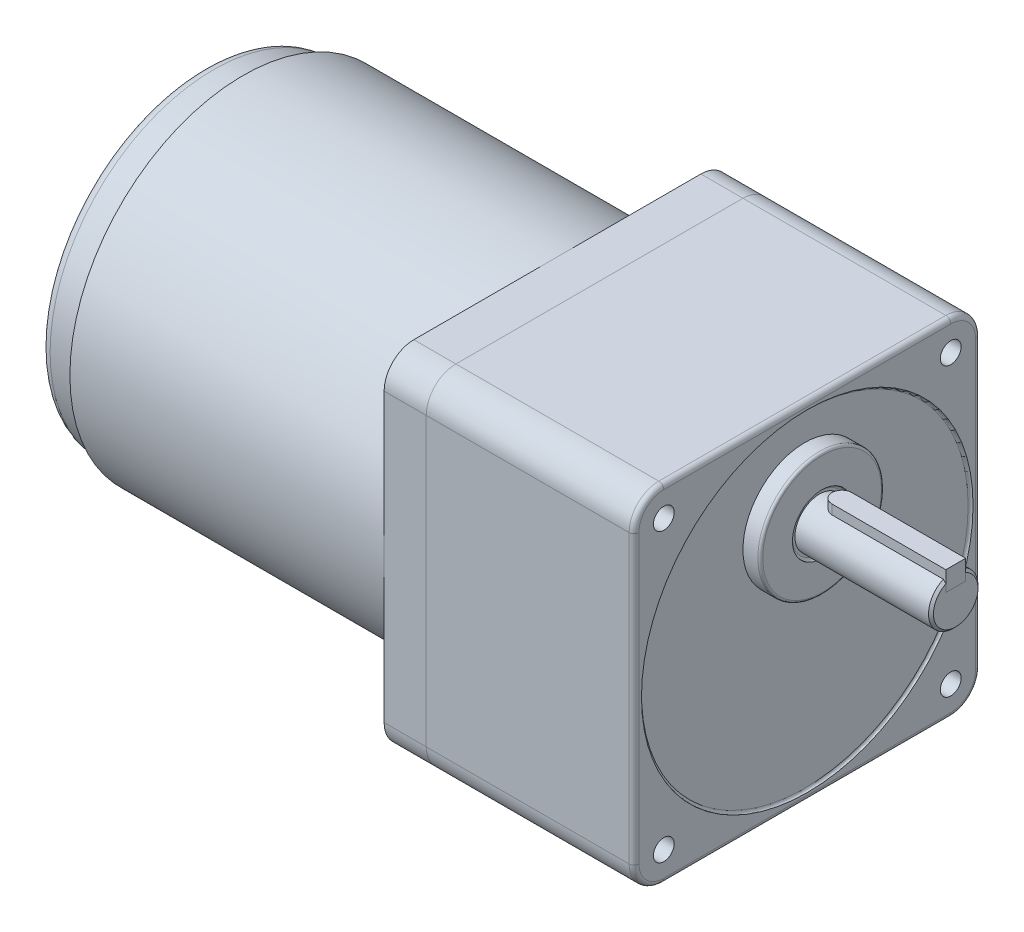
SolidWorks part; units mm, degrees
ref_plane "前视基准面" through (0, 0, 0) normal (0, 0, 1) x (1, 0, 0)
ref_plane "上视基准面" through (0, 0, 0) normal (0, 1, 0) x (1, 0, 0)
ref_plane "右视基准面" through (0, 0, 0) normal (1, 0, 0) x (0, 0, -1)
sketch "草图1" plane through (0, 0, 0) normal (1, 0, 0) x (0, 0, -1)
  line L1 (-29, -35) -> (29, -35)
  line L2 (-35, -29) -> (-35, 29)
  line L3 (-29, 35) -> (29, 35)
  line L4 (35, -29) -> (35, 29)
  line L5 (-35, -35) -> (35, 35) construction
  line L6 (-35, 35) -> (35, -35) construction
  arc A0 (-29, -35) -> (-35, -29) centre (-29, -29) cw
  arc A1 (29, -35) -> (35, -29) centre (29, -29) ccw
  arc A2 (29, 35) -> (35, 29) centre (29, 29) cw
  arc A3 (-35, 29) -> (-29, 35) centre (-29, 29) cw
  point P0 (0, 0)
  dimension "D1" = 6
extrude "凸台-拉伸1" add sketch "草图1" against normal blind 42
sketch "草图2" plane through (-42, 0, 0) normal (-1, 0, 0) x (0, 0, 1)
  line L0 (-29, 35) -> (29, 35) construction
  line L1 (-29, -35) -> (29, -35)
  line L2 (-35, -29) -> (-35, 29)
  line L3 (-29, 35) -> (29, 35)
  line L4 (35, -29) -> (35, 29)
  line L5 (-35, -35) -> (35, 35) construction
  line L6 (-35, 35) -> (35, -35) construction
  arc A0 (29, 35) -> (35, 29) centre (29, 29) cw
  arc A1 (29, -35) -> (35, -29) centre (29, -29) ccw
  arc A2 (-29, -35) -> (-35, -29) centre (-29, -29) cw
  arc A3 (-35, 29) -> (-29, 35) centre (-29, 29) cw
  point P0 (0, 0)
  dimension "D1" = 6
extrude "凸台-拉伸2" add sketch "草图2" along normal blind 8.5 separate body
sketch "草图3" plane through (-50.5, 0, 0) normal (-1, 0, 0) x (0, 0, 1)
  circle A0 centre (0, 0) radius 35
extrude "凸台-拉伸3" add sketch "草图3" along normal blind 63.5
sketch "草图4" plane through (-114, 0, 0) normal (-1, 0, 0) x (0, 0, 1)
  circle A0 centre (0, 0) radius 33
extrude "凸台-拉伸4" add sketch "草图4" along normal blind 8
fillet "圆角1" radius 2 1 edges at (-122, 0, 33)
fillet "圆角2" radius 1 8 edges at (0, 0, 35) (0, 33.2426, 33.2426) (0, 35, 0) (0, 33.2426, -33.2426) (0, 0, -35) (0, -33.2426, -33.2426) (0, -35, 0) (0, -33.2426, 33.2426)
sketch "草图5" plane through (0, 0, 0) normal (1, 0, 0) x (0, 0, -1)
  point P10 (-28.9914, 28.9914)
  point P11 (28.9914, 28.9914)
  point P12 (28.9914, -28.9914)
  point P13 (-28.9914, -28.9914)
hole_wizard "M5 螺纹孔1" positions "3D草图1" profile "草图6" tap size "M5" standard "GB"
sketch3d "3D草图1"
  point P0 (0, 28.9914, 28.9914)
  point P3 (0, 28.9914, -28.9914)
  point P6 (0, -28.9914, -28.9914)
  point P9 (0, -28.9914, 28.9914)
sketch "草图6" plane through (0, 28.9914, 28.9914) normal (0, 1, 0) x (0, 0, -1)
  line L0 (0, 0) -> (0, 15.2618)
  line L1 (0, 15.2618) -> (2.1, 14)
  line L2 (2.1, 14) -> (2.1, 0)
  line L5 (2.1, 0) -> (0, 0)
  line L10 (0, 15.2618) -> (-2.1, 14) construction
  line L11 (0, -6.35) -> (0, 107.95) construction
  dimension "螺纹孔钻头直径" = 4.2
  dimension "螺纹孔钻头深度" = 14
  dimension "导头角度" = 118
sketch "草图7" plane through (0, 0, 0) normal (1, 0, 0) x (0, 0, -1)
  circle A0 centre (0, 0) radius 33.5
extrude "切除-拉伸1" cut sketch "草图7" against normal blind 0.5
fillet "圆角3" radius 0.5 1 edges at (-0.5, 0, -33.5)
sketch "草图8" plane through (-0.5, 0, 0) normal (1, 0, 0) x (0, 0, -1)
  circle A0 centre (0, 15) radius 12.5
extrude "凸台-拉伸5" add sketch "草图8" along normal blind 3.5
fillet "圆角4" radius 0.5 1 edges at (3, 15, -12.5)
sketch "草图9" plane through (3, 0, 0) normal (1, 0, 0) x (0, 0, -1)
  circle A0 centre (0, 15) radius 6
extrude "切除-拉伸2" cut sketch "草图9" against normal blind 0.5
fillet "圆角5" radius 0.5 1 edges at (2.5, 15, -6)
sketch "草图10" plane through (2.5, 0, 0) normal (1, 0, 0) x (0, 0, -1)
  circle A0 centre (0, 15) radius 5
extrude "凸台-拉伸6" add sketch "草图10" along normal blind 27.5
ref_plane "基准面1" through (0, 20, 0) normal (0, 1, 0) x (1, 0, 0)
sketch "草图11" plane through (0, 20, 0) normal (0, 1, 0) x (1, 0, 0)
  line L1 (30, -5) -> (30, 5) construction
  line L2 (7, 2) -> (30, 2)
  line L3 (30, 2) -> (30, -2)
  line L4 (30, -2) -> (7, -2)
  arc A0 (7, 2) -> (7, -2) centre (7, 0) ccw
extrude "切除-拉伸3" cut sketch "草图11" against normal blind 2.5
sketch "草图12" plane through (0, 17.5, 0) normal (0, 1, 0) x (1, 0, 0)
  line L0 (7, 2) -> (30, 2)
  line L1 (30, 2) -> (30, -2)
  line L2 (30, -2) -> (7, -2)
  arc A0 (7, 2) -> (7, -2) centre (7, 0) ccw
extrude "凸台-拉伸7" add sketch "草图12" along normal blind 4 separate body
chamfer "倒角1" distance 0.5 angle 45 1 edges at (30, 10, 0)
